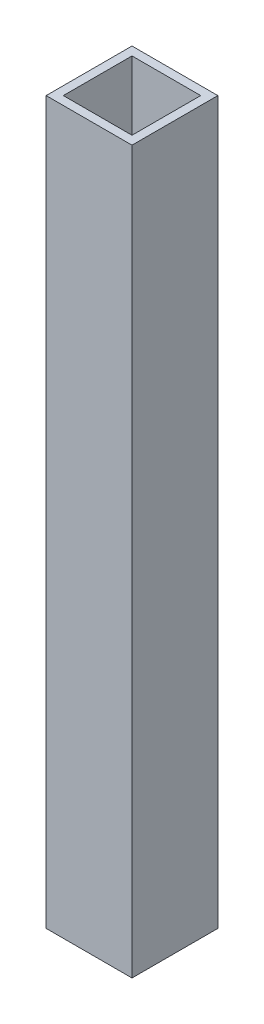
SolidWorks part; units mm, degrees
ref_plane "Plan de face" through (0, 0, 0) normal (0, 0, 1) x (1, 0, 0)
ref_plane "Plan de dessus" through (0, 0, 0) normal (0, 1, 0) x (1, 0, 0)
ref_plane "Plan de droite" through (0, 0, 0) normal (1, 0, 0) x (0, 0, -1)
sketch "Esquisse1" plane through (0, 0, 0) normal (0, 1, 0) x (1, 0, 0)
  line L1 (-5, 5) -> (5, 5)
  line L2 (-5, 5) -> (-5, -5)
  line L3 (-5, -5) -> (5, -5)
  line L4 (5, 5) -> (5, -5)
  line L5 (-5, 5) -> (5, -5) construction
  line L6 (-5, -5) -> (5, 5) construction
  line L7 (-4, -4) -> (4, -4)
  line L8 (-4, -4) -> (-4, 4)
  line L9 (-4, 4) -> (4, 4)
  line L10 (4, -4) -> (4, 4)
  line L11 (-4, -4) -> (4, 4) construction
  line L12 (-4, 4) -> (4, -4) construction
  point P0 (0, 0)
  point P5 (0, 0)
  dimension "D1" = 10
  dimension "D2" = 1
extrude "Boss.-Extru.1" add sketch "Esquisse1" along normal blind 84
